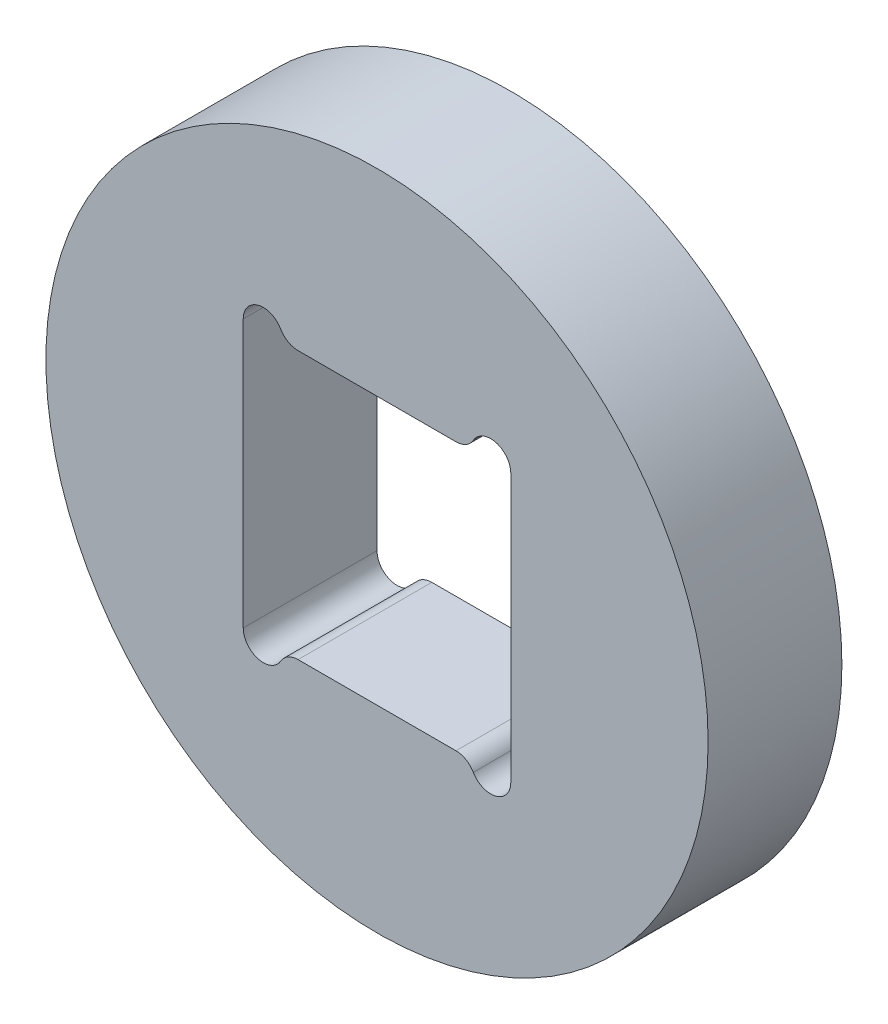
SolidWorks part; units mm, degrees
ref_plane "Plan de face" through (0, 0, 0) normal (0, 0, 1) x (1, 0, 0)
ref_plane "Plan de dessus" through (0, 0, 0) normal (0, 1, 0) x (1, 0, 0)
ref_plane "Plan de droite" through (0, 0, 0) normal (1, 0, 0) x (0, 0, -1)
sketch "Esquisse1" plane through (0, 0, 0) normal (0, 0, 1) x (1, 0, 0)
  line L4 (-5.9019, 10) -> (5.9019, 10)
  line L5 (10, 10) -> (10, -10)
  line L6 (5.9019, -10) -> (-5.9019, -10)
  line L7 (-10, -10) -> (-10, 10)
  arc A0 (-7.201, 10.75) -> (-5.9019, 10) centre (-5.9019, 11.5) ccw
  arc A1 (5.9019, 10) -> (7.201, 10.75) centre (5.9019, 11.5) ccw
  arc A2 (10, 10) -> (7.201, 10.75) centre (8.5, 10) ccw
  arc A3 (7.201, -10.75) -> (10, -10) centre (8.5, -10) ccw
  arc A4 (7.201, -10.75) -> (5.9019, -10) centre (5.9019, -11.5) ccw
  arc A18 (-5.9019, -10) -> (-7.201, -10.75) centre (-5.9019, -11.5) ccw
  arc A19 (-10, -10) -> (-7.201, -10.75) centre (-8.5, -10) ccw
  arc A20 (-7.201, 10.75) -> (-10, 10) centre (-8.5, 10) ccw
  circle A25 centre (0, 0) radius 24.75
  dimension "D5" = 1.5
  dimension "D6" = 1.5
  dimension "D7" = 1.5
  dimension "D8" = 1.5
  dimension "D9" = 1.5
  dimension "D10" = 1.5
  dimension "D11" = 1.5
  dimension "D12" = 1.5
  dimension "D16" = 49.5
  dimension "D1" = 20
  dimension "D2" = 20
  dimension "D3" = 10
  dimension "D4" = 10
extrude "Boss.-Extru.1" add sketch "Esquisse1" along normal blind 10
